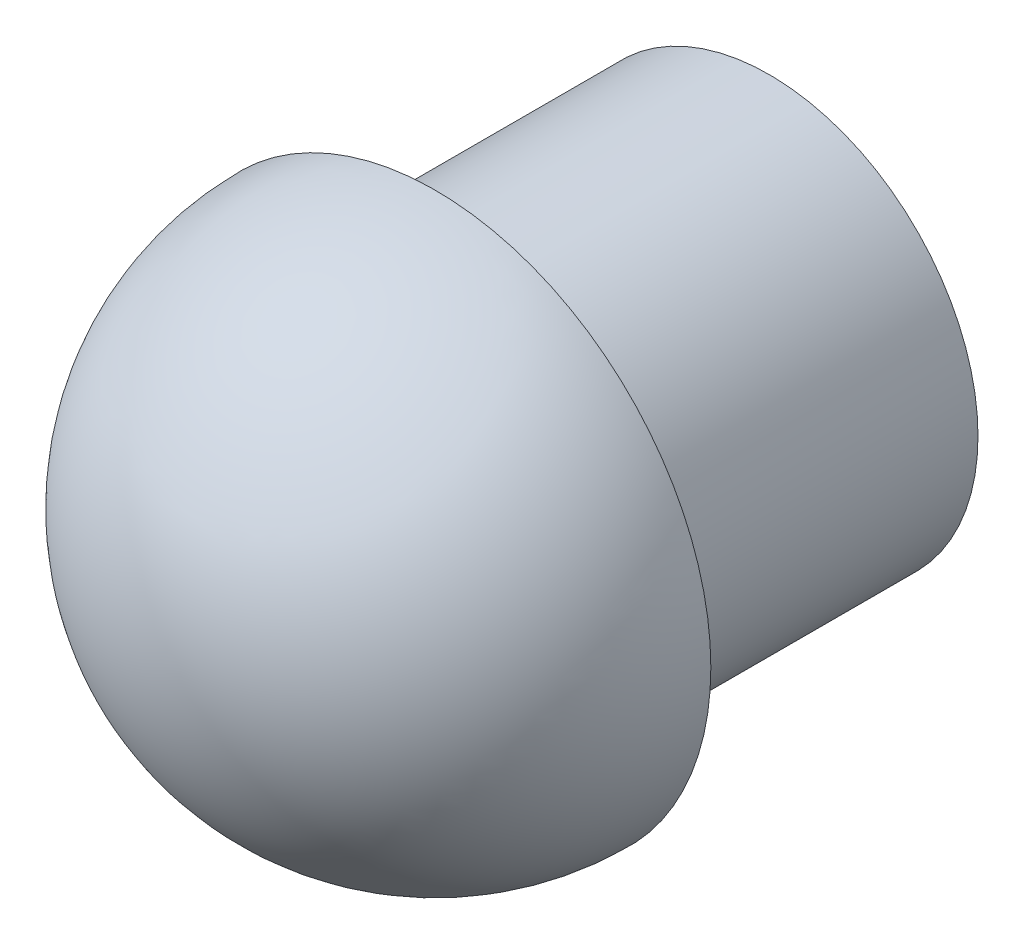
SolidWorks part; units mm, degrees
ref_plane "Plan de face" through (0, 0, 0) normal (0, 0, 1) x (1, 0, 0)
ref_plane "Plan de dessus" through (0, 0, 0) normal (0, 1, 0) x (1, 0, 0)
ref_plane "Plan de droite" through (0, 0, 0) normal (1, 0, 0) x (0, 0, -1)
sketch "Esquisse1" plane through (0, 0, 0) normal (0, 0, 1) x (1, 0, 0)
  circle A0 centre (0, 0) radius 6.25
  dimension "D1" = 12.5
extrude "Boss.-Extru.1" add sketch "Esquisse1" along normal blind 10
sketch "Esquisse2" plane through (0, 0, 10) normal (0, 0, 1) x (1, 0, 0)
  circle A0 centre (0, 0) radius 8.25
  dimension "D1" = 16.5
extrude "Boss.-Extru.2" add sketch "Esquisse2" along normal blind 8.25
fillet "Congé1" radius 8.25 1 edges at (8.25, 0, 18.25)
